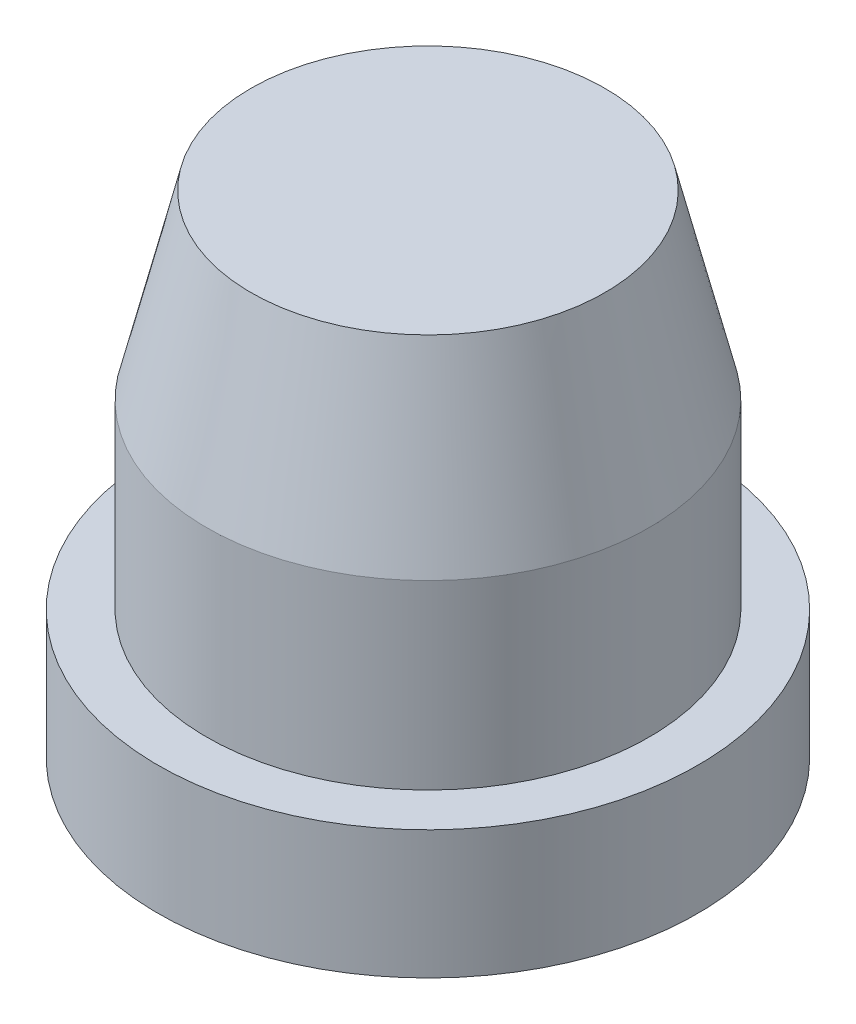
SolidWorks part; units mm, degrees
ref_plane "正面" through (0, 0, 0) normal (0, 0, 1) x (1, 0, 0)
ref_plane "平面" through (0, 0, 0) normal (0, 1, 0) x (1, 0, 0)
ref_plane "右側面" through (0, 0, 0) normal (1, 0, 0) x (0, 0, -1)
sketch "ｽｹｯﾁ1" plane through (0, 0, 0) normal (0, 0, 1) x (1, 0, 0)
  line L0 (0, 0) -> (-6.1, 0)
  line L1 (-6.1, 0) -> (-6.1, 2.9)
  line L2 (-6.1, 2.9) -> (-5, 2.9)
  line L3 (-5, 2.9) -> (-5, 7)
  line L4 (-5, 7) -> (-4, 11.1)
  line L5 (-4, 11.1) -> (0, 11.1)
  line L6 (0, 11.1) -> (0, 0)
  dimension "D1" = 6.1
  dimension "D2" = 11.1
  dimension "D3" = 2.9
  dimension "D4" = 7
  dimension "D5" = 5
  dimension "D6" = 4.1
  dimension "D7" = 4
revolve "回転1" add sketch "ｽｹｯﾁ1" angle 360 about L6
sketch "ｽｹｯﾁ2" plane through (0, 0, 0) normal (0, -1, 0) x (1, 0, 0)
  circle A0 centre (0, 0) radius 2.8
  dimension "D1" = 5.6
extrude "ｶｯﾄ - 押し出し1" cut sketch "ｽｹｯﾁ2" against normal blind 2.3
sketch "ｽｹｯﾁ3" plane through (0, 2.3, 0) normal (0, -1, 0) x (1, 0, 0)
  circle A0 centre (0, 0) radius 4
  dimension "D1" = 8
extrude "ｶｯﾄ - 押し出し2" cut sketch "ｽｹｯﾁ3" against normal offset from surface (7.9 mm away) 10.2
fillet "ﾌｨﾚｯﾄ1" radius 1.5 1 edges at (2.8, 0, 0)
